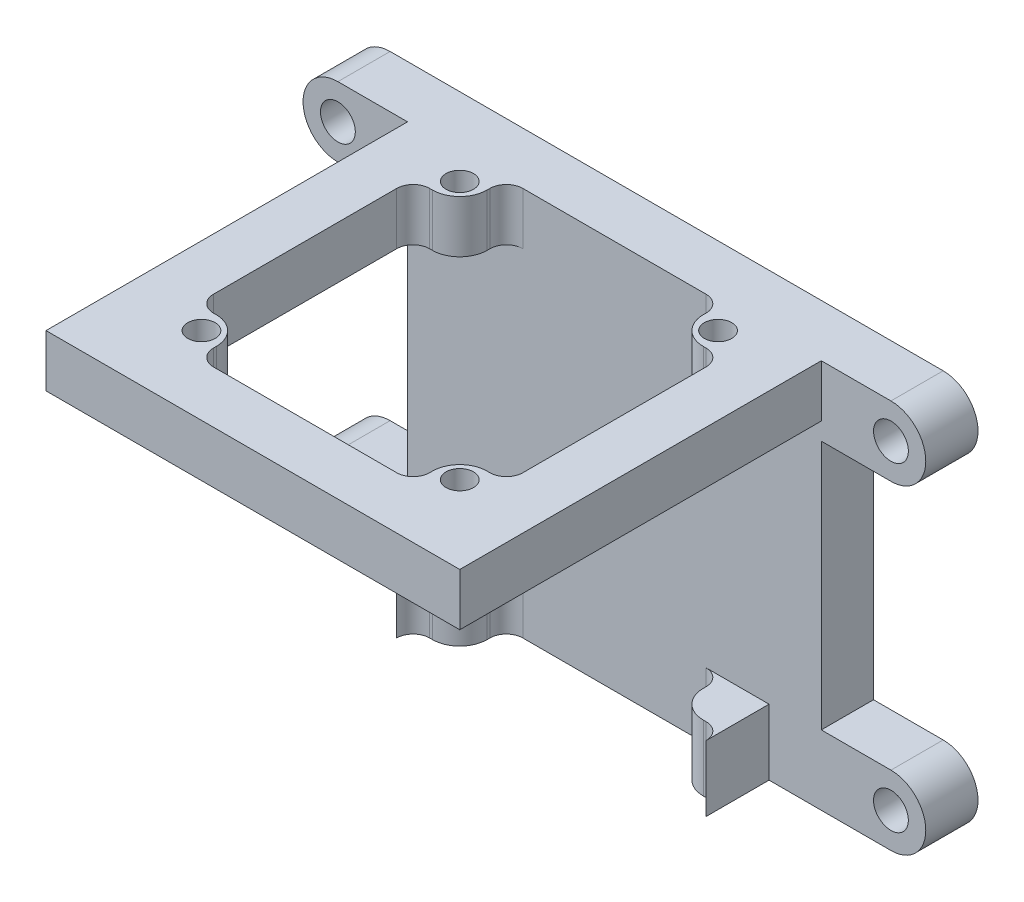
SolidWorks part; units mm, degrees
ref_plane "Front Plane" through (0, 0, 0) normal (0, 0, 1) x (1, 0, 0)
ref_plane "Top Plane" through (0, 0, 0) normal (0, 1, 0) x (1, 0, 0)
ref_plane "Right Plane" through (0, 0, 0) normal (1, 0, 0) x (0, 0, -1)
sketch "Sketch1" plane through (0, 901.9294, 0) normal (0, -1, 0) x (1, 0, 0)
  line L8 (482.2757, 1261.788) -> (482.2757, 1261.288)
  line L9 (487.2757, 1266.788) -> (487.7757, 1266.788)
  line L10 (487.2757, 1306.188) -> (487.7757, 1306.188)
  line L11 (482.2757, 1311.688) -> (482.2757, 1311.188)
  line L12 (442.8758, 1311.688) -> (442.8758, 1311.188)
  line L13 (437.3757, 1306.1879) -> (437.8757, 1306.1879)
  line L14 (437.3757, 1266.788) -> (437.8757, 1266.788)
  line L15 (442.8757, 1261.788) -> (442.8757, 1261.288)
  line L16 (445.8757, 1258.288) -> (479.2757, 1258.288)
  line L17 (490.7757, 1269.788) -> (490.7757, 1303.188)
  line L18 (445.8757, 1314.6879) -> (479.2757, 1314.688)
  line L19 (434.3758, 1303.188) -> (434.3757, 1269.788)
  line L20 (462.5757, 1324.213) -> (462.5757, 1314.688) construction
  line L25 (500.3007, 1286.488) -> (490.7757, 1286.488) construction
  line L26 (424.8507, 1324.213) -> (500.3007, 1324.213)
  line L27 (500.3007, 1324.213) -> (500.3007, 1248.763)
  line L28 (500.3007, 1248.763) -> (424.8507, 1248.763)
  line L29 (424.8507, 1248.763) -> (424.8507, 1324.213)
  arc A0 (479.2757, 1258.288) -> (482.2757, 1261.288) centre (479.2757, 1261.288) ccw construction
  arc A1 (487.2757, 1266.788) -> (482.2757, 1261.788) centre (487.2757, 1261.788) ccw construction
  arc A2 (487.7757, 1266.788) -> (490.7757, 1269.788) centre (487.7757, 1269.788) ccw construction
  arc A3 (442.8757, 1261.288) -> (445.8757, 1258.288) centre (445.8757, 1261.288) ccw construction
  arc A4 (442.8757, 1261.788) -> (437.8757, 1266.788) centre (437.8757, 1261.788) ccw construction
  arc A5 (434.3757, 1269.788) -> (437.3757, 1266.788) centre (437.3757, 1269.788) ccw construction
  arc A6 (490.7757, 1303.188) -> (487.7757, 1306.188) centre (487.7757, 1303.188) ccw construction
  arc A7 (482.2757, 1311.188) -> (487.2757, 1306.188) centre (487.2757, 1311.188) ccw construction
  arc A8 (482.2757, 1311.688) -> (479.2757, 1314.688) centre (479.2757, 1311.688) ccw construction
  arc A9 (445.8757, 1314.6879) -> (442.8758, 1311.688) centre (445.8758, 1311.6879) ccw construction
  arc A10 (437.8757, 1306.1879) -> (442.8758, 1311.188) centre (437.8758, 1311.1879) ccw construction
  arc A11 (437.3757, 1306.1879) -> (434.3758, 1303.188) centre (437.3758, 1303.1879) ccw construction
  arc A12 (479.2757, 1258.288) -> (482.2757, 1261.288) centre (479.2757, 1261.288) ccw
  arc A13 (487.2757, 1266.788) -> (482.2757, 1261.788) centre (487.2757, 1261.788) ccw
  arc A14 (487.7757, 1266.788) -> (490.7757, 1269.788) centre (487.7757, 1269.788) ccw
  arc A15 (442.8757, 1261.288) -> (445.8757, 1258.288) centre (445.8757, 1261.288) ccw
  arc A16 (442.8757, 1261.788) -> (437.8757, 1266.788) centre (437.8757, 1261.788) ccw
  arc A17 (434.3757, 1269.788) -> (437.3757, 1266.788) centre (437.3757, 1269.788) ccw
  arc A18 (490.7757, 1303.188) -> (487.7757, 1306.188) centre (487.7757, 1303.188) ccw
  arc A19 (482.2757, 1311.188) -> (487.2757, 1306.188) centre (487.2757, 1311.188) ccw
  arc A20 (482.2757, 1311.688) -> (479.2757, 1314.688) centre (479.2757, 1311.688) ccw
  arc A21 (445.8757, 1314.6879) -> (442.8758, 1311.688) centre (445.8758, 1311.6879) ccw
  arc A22 (437.8757, 1306.1879) -> (442.8758, 1311.188) centre (437.8758, 1311.1879) ccw
  arc A23 (437.3757, 1306.1879) -> (434.3758, 1303.188) centre (437.3758, 1303.1879) ccw
  circle A24 centre (439.0257, 1262.938) radius 2.5
  circle A25 centre (439.0257, 1310.038) radius 2.5
  circle A26 centre (486.1257, 1262.938) radius 2.5
  arc A27 (486.1257, 1260.438) -> (486.1257, 1265.438) centre (486.1257, 1262.938) ccw construction
  circle A28 centre (486.1257, 1310.038) radius 2.5
  arc A29 (486.1257, 1307.538) -> (486.1257, 1312.538) centre (486.1257, 1310.038) ccw construction
  point P42 (462.5757, 1324.213)
  dimension "D1" = 9.525
  dimension "D2" = 9.525
extrude "Boss-Extrude2" add sketch "Sketch1" along normal blind 9.525
sketch "Sketch2" plane through (0, 892.4044, 0) normal (0, -1, 0) x (1, 0, 0)
  line L0 (500.3007, 1248.763) -> (500.3007, 1324.213) construction
  line L1 (424.8507, 1248.763) -> (500.3007, 1248.763)
  line L2 (424.8507, 1248.763) -> (424.8507, 1258.288)
  line L3 (424.8507, 1258.288) -> (500.3007, 1258.288)
  line L4 (500.3007, 1248.763) -> (500.3007, 1258.288)
  line L5 (445.8757, 1258.288) -> (479.2757, 1258.288) construction
extrude "Boss-Extrude3" add sketch "Sketch2" along normal up to vertex (61.475 mm away)
sketch "Sketch3" plane through (0, 830.9294, 0) normal (0, -1, 0) x (1, 0, 0)
  line L0 (487.2757, 1266.788) -> (487.7757, 1266.788) construction
  line L1 (482.2757, 1261.288) -> (482.2757, 1261.788) construction
  line L2 (437.3757, 1266.788) -> (437.8757, 1266.788) construction
  line L3 (442.8757, 1261.788) -> (442.8757, 1261.288) construction
  line L4 (487.2757, 1266.788) -> (487.7757, 1266.788)
  line L5 (482.2757, 1261.288) -> (482.2757, 1261.788)
  line L6 (437.3757, 1266.788) -> (437.8757, 1266.788)
  line L7 (442.8757, 1261.788) -> (442.8757, 1261.288)
  line L8 (479.2757, 1258.288) -> (490.7757, 1258.288)
  line L9 (500.3007, 1258.288) -> (424.8507, 1258.288) construction
  line L10 (490.7757, 1258.288) -> (490.7757, 1269.788)
  line L11 (434.3757, 1269.788) -> (434.3757, 1258.288)
  line L12 (434.3757, 1258.288) -> (445.8757, 1258.288)
  arc A0 (487.7757, 1266.788) -> (490.7757, 1269.788) centre (487.7757, 1269.788) ccw construction
  arc A1 (487.2757, 1266.788) -> (482.2757, 1261.788) centre (487.2757, 1261.788) ccw construction
  arc A2 (479.2757, 1258.288) -> (482.2757, 1261.288) centre (479.2757, 1261.288) ccw construction
  arc A3 (434.3757, 1269.788) -> (437.3757, 1266.788) centre (437.3757, 1269.788) ccw construction
  arc A4 (442.8757, 1261.788) -> (437.8757, 1266.788) centre (437.8757, 1261.788) ccw construction
  arc A5 (442.8757, 1261.288) -> (445.8757, 1258.288) centre (445.8757, 1261.288) ccw construction
  arc A6 (487.7757, 1266.788) -> (490.7757, 1269.788) centre (487.7757, 1269.788) ccw
  arc A7 (487.2757, 1266.788) -> (482.2757, 1261.788) centre (487.2757, 1261.788) ccw
  arc A8 (479.2757, 1258.288) -> (482.2757, 1261.288) centre (479.2757, 1261.288) ccw
  arc A9 (434.3757, 1269.788) -> (437.3757, 1266.788) centre (437.3757, 1269.788) ccw
  arc A10 (442.8757, 1261.788) -> (437.8757, 1266.788) centre (437.8757, 1261.788) ccw
  arc A11 (442.8757, 1261.288) -> (445.8757, 1258.288) centre (445.8757, 1261.288) ccw
extrude "Boss-Extrude4" add sketch "Sketch3" against normal up to vertex (12 mm away)
sketch "Sketch7" plane through (0, 0, 1248.763) normal (0, 0, -1) x (-1, 0, 0)
  line L0 (-500.3007, 901.9294) -> (-513.0007, 901.9294)
  line L2 (-513.0007, 889.2294) -> (-500.3007, 889.2294)
  line L3 (-500.3007, 830.9294) -> (-500.3007, 901.9294) construction
  line L4 (-500.3007, 889.2294) -> (-500.3007, 901.9294)
  line L5 (-463.1522, 901.9294) -> (-462.5757, 901.9294) construction
  line L6 (-424.8507, 901.9294) -> (-500.3007, 901.9294) construction
  line L7 (-462.5757, 901.9294) -> (-462.5757, 830.9294) construction
  line L8 (-424.8507, 830.9294) -> (-500.3007, 830.9294) construction
  line L9 (-424.8507, 889.2294) -> (-424.8507, 901.9294)
  line L10 (-412.1507, 889.2294) -> (-424.8507, 889.2294)
  line L11 (-424.8507, 901.9294) -> (-412.1507, 901.9294)
  line L12 (-462.5757, 866.4294) -> (-500.3007, 866.4294) construction
  line L13 (-463.1522, 830.9294) -> (-462.5757, 830.9294) construction
  line L14 (-424.8507, 830.9294) -> (-412.1507, 830.9294)
  line L15 (-412.1507, 843.6294) -> (-424.8507, 843.6294)
  line L16 (-424.8507, 843.6294) -> (-424.8507, 830.9294)
  line L17 (-500.3007, 843.6294) -> (-500.3007, 830.9294)
  line L18 (-513.0007, 843.6294) -> (-500.3007, 843.6294)
  line L19 (-500.3007, 830.9294) -> (-513.0007, 830.9294)
  arc A0 (-513.0007, 901.9294) -> (-513.0007, 889.2294) centre (-513.0007, 895.5794) ccw
  circle A1 centre (-513.0007, 895.5794) radius 3.175
  circle A2 centre (-412.1507, 895.5794) radius 3.175
  arc A3 (-412.1507, 901.9294) -> (-412.1507, 889.2294) centre (-412.1507, 895.5794) cw
  arc A4 (-412.1507, 830.9294) -> (-412.1507, 843.6294) centre (-412.1507, 837.2794) ccw
  circle A5 centre (-412.1507, 837.2794) radius 3.175
  circle A6 centre (-513.0007, 837.2794) radius 3.175
  arc A7 (-513.0007, 830.9294) -> (-513.0007, 843.6294) centre (-513.0007, 837.2794) cw
  dimension "D3" = 6.35
  dimension "D1" = 12.7
  dimension "D2" = 12.7
extrude "Boss-Extrude8" add sketch "Sketch7" against normal up to surface (9.525 mm away)
